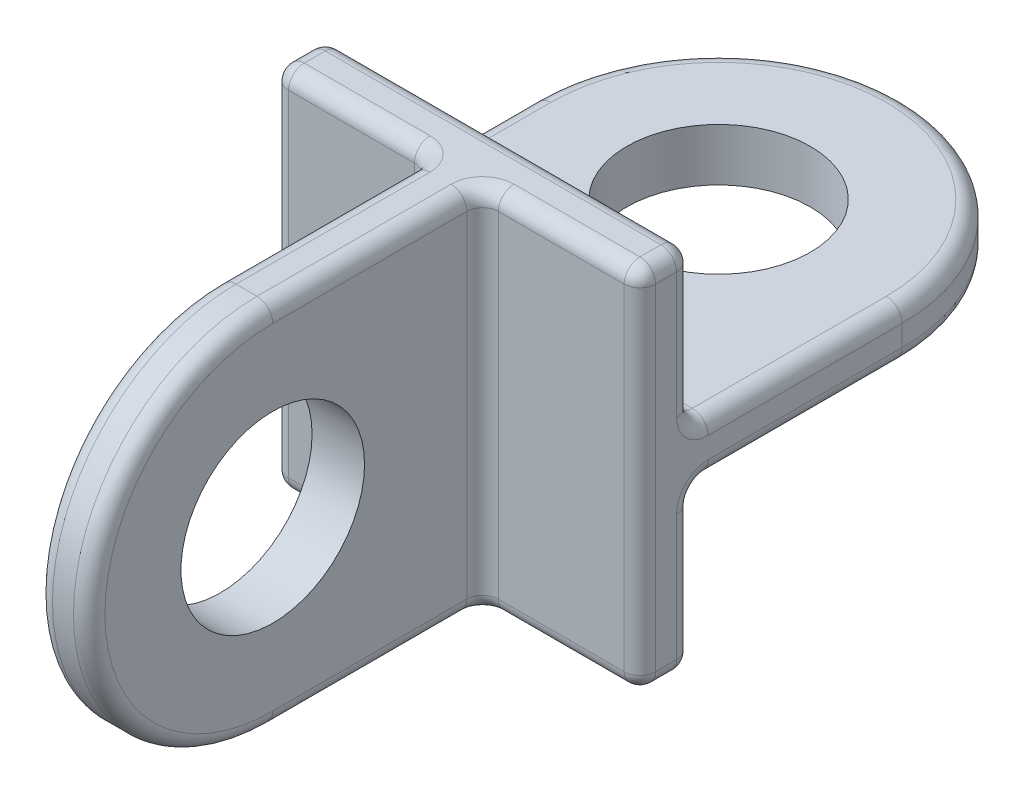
SolidWorks part; units mm, degrees
extrude "Base-Extrude" add sketch "Sketch1" along normal mid plane 10
sketch "Sketch1" plane through (0, 0, 0) normal (0, 0, 1) x (1, 0, 0)
  line L0 (-35, 35) -> (35, -35) construction
  line L1 (-35, -35) -> (35, -35)
  line L2 (-35, -35) -> (-35, 35)
  line L3 (-35, 35) -> (35, 35)
  line L4 (35, -35) -> (35, 35)
  dimension "D1" = 70
fillet "Fillet2" radius 3 40 edges at (0, -5, -80) (0, 5, -80) (5, 0, 80) (-5, 0, 80) (-35, 0, 5) (0, 35, -5) (34.1213, 34.1213, -5) (-34.1213, 34.1213, -5) (-34.1213, -34.1213, 5) (-34.1213, 34.1213, 5) (0, -35, -5) (34.1213, -34.1213, -5) (-34.1213, -34.1213, -5) (35, 0, 5) (34.1213, 34.1213, 5) (34.1213, -34.1213, 5) (5.8787, 35, 5.8787) (5.8787, -35, 5.8787) (-5.8787, 35, 5.8787) (-5.8787, -35, 5.8787) (-35, 5.8787, -5.8787) (35, 5.8787, -5.8787) (-35, -5.8787, -5.8787) (35, -5.8787, -5.8787)
fillet "Fillet1" radius 3 20 edges at (-35, 35, 0) (35, 35, 0) (35, -35, 0) (-35, -35, 0)
extrude "Boss-Extrude2" add sketch "Sketch3" along normal mid plane 10
sketch "Sketch3" plane through (0, 0, -10) normal (1, 0, 0) x (0, -1, 0)
  line L0 (-35, -15) -> (-35, -55)
  line L1 (-35, -15) -> (35, -15)
  line L2 (35, -15) -> (35, -55)
  line L3 (35, -15) -> (-35, -15) construction
  line L4 (35, -15) -> (35, -5) construction
  arc A0 (-35, -55) -> (35, -55) centre (0, -55) ccw
  circle A1 centre (0, -55) radius 17.5
extrude "Boss-Extrude1" add sketch "Sketch2" along normal mid plane 10
sketch "Sketch2" plane through (0, 0, 10) normal (0, -1, 0) x (1, 0, 0)
  line L0 (-35, -15) -> (-35, -55)
  line L1 (-35, -15) -> (35, -15)
  line L2 (35, -15) -> (35, -55)
  line L3 (35, -15) -> (-35, -15) construction
  line L4 (-35, -5) -> (-35, -15) construction
  line L5 (35, -5) -> (35, -15) construction
  arc A0 (-35, -55) -> (35, -55) centre (0, -55) ccw
  circle A1 centre (0, -55) radius 17.5
  dimension "D2" = 35
  dimension "D1" = 40
ref_plane "Front" through (0, 0, 0) normal (0, 0, 1) x (1, 0, 0)
ref_plane "Top" through (0, 0, 0) normal (0, 1, 0) x (1, 0, 0)
ref_plane "Right" through (0, 0, 0) normal (1, 0, 0) x (0, 0, -1)
